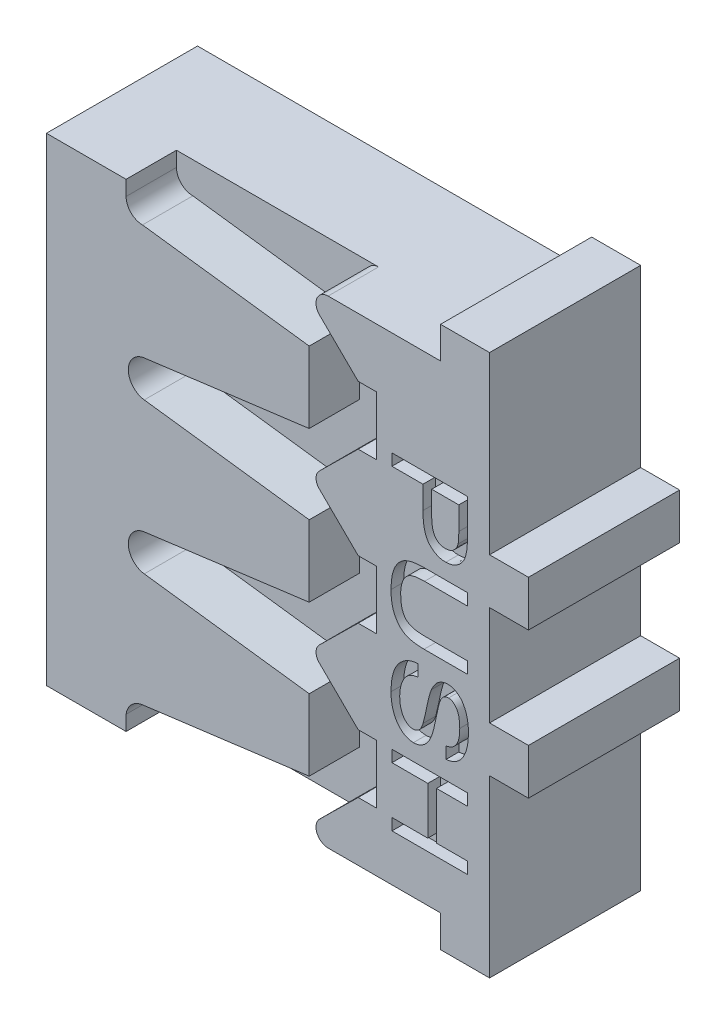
SolidWorks part; units mm, degrees
ref_plane "Plan de face" through (0, 0, 0) normal (0, 0, 1) x (1, 0, 0)
ref_plane "Plan de dessus" through (0, 0, 0) normal (0, 1, 0) x (1, 0, 0)
ref_plane "Plan de droite" through (0, 0, 0) normal (1, 0, 0) x (0, 0, -1)
sketch "Esquisse1" plane through (0, 0, 0) normal (0, 0, 1) x (1, 0, 0)
  line L35 (-2.5501, 0.5149) -> (-2.4893, 0.4539)
  line L36 (-2.701, 0.5149) -> (-2.0714, 0.5149)
  line L37 (-2.0714, 0.5149) -> (-1.3877, 0.4008)
  line L38 (-1.3877, 0.4008) -> (-1.2172, 0.4008)
  line L39 (-2.5501, 0.682) -> (-2.4893, 0.7426)
  line L40 (-2.701, 0.682) -> (-2.0714, 0.682)
  line L41 (-2.0714, 0.682) -> (-1.3877, 0.7956)
  line L42 (-1.3877, 0.7956) -> (-1.2172, 0.7956)
  line L43 (-0.8999, 1.3159) -> (-1.2011, 1.3159)
  line L44 (-1.2011, 1.3159) -> (-1.2011, 1.0799)
  line L45 (-1.2011, 1.0799) -> (-0.8999, 1.0799)
  line L46 (-2.6172, 1.8995) -> (-2.6172, 2.2877)
  line L47 (-2.6172, 2.2877) -> (-1.0573, 2.2877)
  line L48 (-1.0573, 2.2877) -> (-1.0573, 1.8981)
  line L49 (-2.5442, 1.7055) -> (-2.4893, 1.6504)
  line L50 (-2.5966, 1.7055) -> (-2.0714, 1.7055)
  line L51 (-2.0714, 1.7055) -> (-1.4547, 1.6025)
  line L52 (-1.4547, 1.6025) -> (-1.2149, 1.6025)
  line L53 (0.309, 0.7598) -> (0, 0.7598)
  line L54 (-2.6172, 2.1506) -> (-1.0573, 2.1506)
  line L55 (-2.5501, -0.5149) -> (-2.4893, -0.4539)
  line L56 (-2.701, -0.5149) -> (-2.0714, -0.5149)
  line L57 (-2.0714, -0.5149) -> (-1.3877, -0.4008)
  line L58 (-1.3877, -0.4008) -> (-1.2172, -0.4008)
  line L59 (-2.5501, -0.682) -> (-2.4893, -0.7426)
  line L60 (-2.701, -0.682) -> (-2.0714, -0.682)
  line L61 (-2.0714, -0.682) -> (-1.3877, -0.7956)
  line L62 (-1.3877, -0.7956) -> (-1.2172, -0.7956)
  line L63 (-0.8999, -1.3159) -> (-1.2011, -1.3159)
  line L64 (-1.2011, -1.3159) -> (-1.2011, -1.0795)
  line L65 (-1.2011, -1.0795) -> (-0.8999, -1.0795)
  line L66 (-2.6172, -1.8995) -> (-2.6172, -2.2877)
  line L67 (-2.6172, -2.2877) -> (-1.0573, -2.2877)
  line L68 (-1.0573, -2.2877) -> (-1.0573, -1.8981)
  line L69 (0, -0.7598) -> (0, -2.1509)
  line L70 (0, -2.1509) -> (-0.3891, -2.1509)
  line L71 (-0.3891, -2.1509) -> (-0.3891, -1.8981)
  line L72 (-0.3891, -1.8981) -> (-1.2819, -1.8981)
  line L73 (-1.3519, -1.7351) -> (-1.0435, -1.4313)
  line L74 (-1.0435, -1.4313) -> (-0.8999, -1.4313)
  line L75 (-0.8999, -1.4313) -> (-0.8999, -0.9645)
  line L76 (-0.8999, -0.9645) -> (-1.0435, -0.9645)
  line L77 (-1.0435, -0.9645) -> (-1.3519, -0.6606)
  line L78 (-1.3519, -0.5362) -> (-1.0435, -0.2324)
  line L79 (-1.0435, -0.2324) -> (-0.8999, -0.2324)
  line L80 (-0.8999, -0.2324) -> (-0.8999, 0.2324)
  line L81 (-0.8999, 0.2324) -> (-1.0435, 0.2324)
  line L82 (-1.0435, 0.2324) -> (-1.3519, 0.5362)
  line L83 (-1.3519, 0.6603) -> (-1.0435, 0.9645)
  line L84 (-1.0435, 0.9645) -> (-0.8999, 0.9645)
  line L85 (-0.8999, 0.9645) -> (-0.8999, 1.4313)
  line L86 (-0.8999, 1.4313) -> (-1.0435, 1.4313)
  line L87 (-1.0435, 1.4313) -> (-1.3519, 1.7351)
  line L88 (-1.2819, 1.8981) -> (-0.3891, 1.8981)
  line L89 (-0.3891, 1.8981) -> (-0.3891, 2.1506)
  line L90 (-0.3891, 2.1506) -> (0, 2.1506)
  line L91 (0, 2.1506) -> (0, 0.7598)
  line L92 (-2.5442, -1.7055) -> (-2.4893, -1.6504)
  line L93 (-2.5966, -1.7055) -> (-2.0714, -1.7055)
  line L94 (-2.0714, -1.7055) -> (-1.4547, -1.6025)
  line L95 (-1.4547, -1.6025) -> (-1.2149, -1.6025)
  line L96 (0, -0.8556) -> (0.309, -0.8556)
  line L97 (0.309, -0.8556) -> (0.309, -0.3967)
  line L98 (0.309, -0.3967) -> (0, -0.3967)
  line L99 (0, -0.3967) -> (0, 0.3967)
  line L100 (0, 0.3967) -> (0.309, 0.3967)
  line L101 (0.309, 0.3967) -> (0.309, 0.8559)
  line L102 (0.309, 0.8559) -> (0, 0.8559)
  line L103 (0.309, -0.7598) -> (0, -0.7598)
  line L104 (-2.6172, -2.1509) -> (-1.0573, -2.1509)
  line L105 (-2.5966, -1.6504) -> (-2.5966, -1.8995)
  line L106 (-2.5966, -1.8995) -> (-3.5193, -1.8995)
  line L107 (-3.5193, -1.8995) -> (-3.5193, 1.8995)
  line L108 (-3.5193, 1.8995) -> (-2.5966, 1.8995)
  line L109 (-2.5966, 1.8995) -> (-2.5966, 1.6504)
  line L110 (-2.7423, 0.7426) -> (-1.4325, 0.9121)
  line L111 (-1.4325, 0.9121) -> (-1.4325, 1.4792)
  line L112 (-1.4325, 1.4792) -> (-2.7564, 1.6504)
  line L113 (-2.701, 0.7426) -> (-2.701, 0.4539)
  line L114 (-0.8999, 0.117) -> (-1.2011, 0.117)
  line L115 (-1.2011, 0.117) -> (-1.2011, -0.1194)
  line L116 (-1.2011, -0.1194) -> (-0.8999, -0.1194)
  line L117 (-2.7423, -0.4539) -> (-1.4325, -0.2827)
  line L118 (-1.4325, -0.2827) -> (-1.4325, 0.2844)
  line L119 (-1.4325, 0.2844) -> (-2.7423, 0.4539)
  line L120 (-2.8866, -1.8995) -> (-2.8866, -1.7806)
  line L121 (-2.7564, -1.6504) -> (-2.133, -1.6504)
  line L122 (-2.133, -1.6504) -> (-1.3932, -1.5546)
  line L123 (-1.3932, -1.5546) -> (-1.3932, -0.8387)
  line L124 (-1.3932, -0.8387) -> (-2.133, -0.7426)
  line L125 (-2.133, -0.7426) -> (-2.7423, -0.7426)
  line L126 (-2.7423, -0.4539) -> (-2.133, -0.4539)
  line L127 (-2.133, -0.4539) -> (-1.3932, -0.3581)
  line L128 (-1.3932, -0.3581) -> (-1.3932, 0.3581)
  line L129 (-1.3932, 0.3581) -> (-2.133, 0.4539)
  line L130 (-2.133, 0.4539) -> (-2.7423, 0.4539)
  line L131 (-2.7423, 0.7426) -> (-2.133, 0.7426)
  line L132 (-2.133, 0.7426) -> (-1.3932, 0.8387)
  line L133 (-1.3932, 0.8387) -> (-1.3932, 1.5546)
  line L134 (-1.3932, 1.5546) -> (-2.133, 1.6504)
  line L135 (-2.133, 1.6504) -> (-2.7564, 1.6504)
  line L136 (-2.8866, 1.7809) -> (-2.8866, 1.8995)
  line L137 (-2.7423, -0.7426) -> (-1.4325, -0.9121)
  line L138 (-1.4325, -0.9121) -> (-1.4325, -1.4792)
  line L139 (-1.4325, -1.4792) -> (-2.7564, -1.6504)
  line L140 (-2.701, -0.7426) -> (-2.701, -0.4539)
  line L141 (-0.7752, 1.1501) -> (-0.7752, -0.9096) construction
  line L142 (-3.3174, -1.001) -> (-3.3174, -1.3134) construction
  spline S19 degree 3 poles (-1.2819, -1.8981) (-1.3377, -1.8981) (-1.3827, -1.8533) (-1.3827, -1.7971) knots 4 4 4 4 5 5 5 5
  spline S20 degree 3 poles (-1.3827, -1.7971) (-1.3827, -1.7744) (-1.3679, -1.7537) (-1.3519, -1.7351) knots 5 5 5 5 6 6 6 6
  spline S21 degree 3 poles (-1.3519, -0.6606) (-1.3679, -0.642) (-1.3827, -0.6213) (-1.3827, -0.5982) knots 11 11 11 11 12 12 12 12
  spline S22 degree 3 poles (-1.3827, -0.5982) (-1.3827, -0.5752) (-1.3679, -0.5545) (-1.3519, -0.5362) knots 12 12 12 12 13 13 13 13
  spline S23 degree 3 poles (-1.3519, 0.5362) (-1.3679, 0.5545) (-1.3827, 0.5755) (-1.3827, 0.5982) knots 18 18 18 18 19 19 19 19
  spline S24 degree 3 poles (-1.3827, 0.5982) (-1.3827, 0.6213) (-1.3679, 0.6423) (-1.3519, 0.6603) knots 19 19 19 19 20 20 20 20
  spline S25 degree 3 poles (-1.3519, 1.7351) (-1.3679, 1.7534) (-1.3827, 1.7744) (-1.3827, 1.7975) knots 25 25 25 25 26 26 26 26
  spline S26 degree 3 poles (-1.3827, 1.7975) (-1.3827, 1.8529) (-1.3377, 1.8981) (-1.2819, 1.8981) knots 26 26 26 26 27 27 27 27
  spline S27 degree 3 poles (-2.8866, -1.7806) (-2.8866, -1.7089) (-2.8284, -1.6504) (-2.7564, -1.6504) knots 1 1 1 1 2 2 2 2
  spline S28 degree 3 poles (-2.7423, -0.7426) (-2.8222, -0.7426) (-2.8866, -0.6782) (-2.8866, -0.5982) knots 7 7 7 7 8 8 8 8
  spline S29 degree 3 poles (-2.8866, -0.5982) (-2.8866, -0.5187) (-2.8222, -0.4539) (-2.7423, -0.4539) knots 8 8 8 8 9 9 9 9
  spline S30 degree 3 poles (-2.7423, 0.4539) (-2.8222, 0.4539) (-2.8866, 0.5187) (-2.8866, 0.5982) knots 14 14 14 14 15 15 15 15
  spline S31 degree 3 poles (-2.8866, 0.5982) (-2.8866, 0.6778) (-2.8222, 0.7426) (-2.7423, 0.7426) knots 15 15 15 15 16 16 16 16
  spline S32 degree 3 poles (-2.7564, 1.6504) (-2.8284, 1.6504) (-2.8866, 1.7086) (-2.8866, 1.7809) knots 21 21 21 21 22 22 22 22
  text T1 "PUSH" font "ARIAL" height 0.6559
  text T2 "3" font "ARIAL" height 0.4778
sketch "Esquisse2" plane through (0, 0, 0) normal (0, 0, 1) x (1, 0, 0)
  line L0 (-3.5193, -1.8995) -> (-0.3891, -1.8981)
  line L1 (-0.3891, -1.8981) -> (-0.3891, -2.1509)
  line L2 (-0.3891, -2.1509) -> (0, -2.1509)
  line L3 (0, -2.1509) -> (0, -0.7598)
  line L4 (0, -0.7598) -> (0.309, -0.7598)
  line L5 (0.309, -0.7598) -> (0.309, -0.3967)
  line L6 (0.309, -0.3967) -> (0, -0.3967)
  line L7 (0, -0.3967) -> (0, 0.3967)
  line L8 (0, 0.3967) -> (0.309, 0.3967)
  line L9 (0.309, 0.3967) -> (0.309, 0.7598)
  line L10 (0.309, 0.7598) -> (0, 0.7598)
  line L11 (0, 0.7598) -> (0, 2.1506)
  line L12 (0, 2.1506) -> (-0.3891, 2.1506)
  line L13 (-0.3891, 2.1506) -> (-0.3891, 1.8981)
  line L14 (-0.3891, 1.8981) -> (-3.5193, 1.8995)
  line L15 (-3.5193, 1.8995) -> (-3.5193, -1.8995)
extrude "Extrusion1" add sketch "Esquisse2" against normal blind 1.2
sketch "Esquisse3" plane through (0, 0, -1.2) normal (0, 0, -1) x (-1, 0, 0)
  line L0 (2.8866, 1.8995) -> (2.8866, 1.7809)
  line L1 (2.7564, 1.6504) -> (1.4325, 1.4792)
  line L2 (1.4325, 1.4792) -> (1.4325, 0.9121)
  line L3 (1.4325, 0.9121) -> (2.7423, 0.7426)
  line L4 (2.7423, 0.4539) -> (1.4325, 0.2844)
  line L5 (1.4325, 0.2844) -> (1.4325, -0.2827)
  line L6 (1.4325, -0.2827) -> (2.7423, -0.4539)
  line L7 (2.7423, -0.7426) -> (1.4325, -0.9121)
  line L8 (1.4325, -0.9121) -> (1.4325, -1.4792)
  line L9 (1.4325, -1.4792) -> (2.7564, -1.6504)
  line L10 (2.8866, -1.7806) -> (2.8866, -1.8995)
  line L11 (2.8866, -1.8995) -> (2.8866, -1.9488)
  line L12 (1.3519, -1.7351) -> (1.0435, -1.4313)
  line L14 (1.0435, -1.4313) -> (0.8999, -1.4313)
  line L15 (0.8999, -1.4313) -> (0.8999, -0.9645)
  line L16 (0.8999, -0.9645) -> (1.0435, -0.9645)
  line L17 (1.0435, -0.9645) -> (1.3519, -0.6606)
  line L18 (1.3519, -0.5362) -> (1.0435, -0.2324)
  line L19 (1.0435, -0.2324) -> (0.8999, -0.2324)
  line L20 (0.8999, -0.2324) -> (0.8999, 0.2324)
  line L21 (0.8999, 0.2324) -> (1.0435, 0.2324)
  line L22 (1.0435, 0.2324) -> (1.3519, 0.5362)
  line L23 (1.3519, 0.6603) -> (1.0435, 0.9645)
  line L24 (1.0435, 0.9645) -> (0.8999, 0.9645)
  line L25 (0.8999, 0.9645) -> (0.8999, 1.4313)
  line L26 (0.8999, 1.4313) -> (1.0435, 1.4313)
  line L27 (1.0435, 1.4313) -> (1.3519, 1.7351)
  line L28 (1.2819, 1.8981) -> (1.2819, 1.9255)
  line L29 (1.2819, 1.9255) -> (2.8866, 1.9255)
  line L30 (2.8866, 1.9255) -> (2.8866, 1.8995)
  line L31 (2.8866, -1.9488) -> (1.2819, -1.9488)
  line L32 (1.2819, -1.9488) -> (1.2819, -1.8981)
  arc A0 (2.8866, 1.7809) -> (2.7564, 1.6504) centre (2.7561, 1.7809) cw
  arc A1 (2.7423, 0.7426) -> (2.7423, 0.4539) centre (2.7236, 0.5982) cw
  arc A2 (2.7423, -0.4539) -> (2.7423, -0.7426) centre (2.7234, -0.5982) cw
  arc A3 (2.7564, -1.6504) -> (2.8866, -1.7806) centre (2.7371, -1.7999) cw
  arc A4 (1.2819, -1.8981) -> (1.3519, -1.7351) centre (1.282, -1.8016) ccw
  arc A5 (1.3519, -0.6606) -> (1.3519, -0.5362) centre (1.2906, -0.5984) ccw
  arc A6 (1.3519, 0.5362) -> (1.3519, 0.6603) centre (1.2907, 0.5982) ccw
  arc A7 (1.3519, 1.7351) -> (1.2819, 1.8981) centre (1.282, 1.8016) ccw
extrude "Enlèv. mat.-Extru.1" cut sketch "Esquisse3" along normal blind 0.4 from vertex at -1.2
sketch "Esquisse4" plane through (-3.5193, 0, 0) normal (-1, 0, 0) x (0, 0, 1)
  line L0 (0, 0) -> (-1.2, 0) construction
  line L1 (-0.2, 1.7) -> (-1, 1.7)
  line L2 (-0.2, 1.7) -> (-0.2, 0.7)
  line L3 (-0.2, 0.7) -> (-1, 0.7)
  line L4 (-1, 1.7) -> (-1, 0.7)
  line L5 (-0.2, 0.5) -> (-1, 0.5)
  line L6 (-0.2, 0.5) -> (-0.2, -0.5)
  line L7 (-0.2, -0.5) -> (-1, -0.5)
  line L8 (-1, 0.5) -> (-1, -0.5)
  line L9 (-0.2, -0.7) -> (-1, -0.7)
  line L10 (-0.2, -0.7) -> (-0.2, -1.7)
  line L11 (-0.2, -1.7) -> (-1, -1.7)
  line L12 (-1, -0.7) -> (-1, -1.7)
  line L13 (0, 1.8995) -> (0, -1.8995) construction
  line L14 (-1.2, 1.8995) -> (-1.2, -1.8995) construction
  line L15 (0, -1.8995) -> (0, 1.8995) construction
  point P18 (-0.2, 0)
  dimension "D1" = 1.2
  dimension "D2" = 1.2
  dimension "D3" = 0.2
  dimension "L" = 1
  dimension "D4" = 0.2
extrude "Enlèv. mat.-Extru.2" cut sketch "Esquisse4" against normal blind 2 draft 10
sketch "Esquisse6" plane through (0, 0, 0) normal (0, 0, 1) x (1, 0, 0)
  line L0 (-0.7752, 1.1501) -> (-0.7752, -1.1501) construction
  text T0 "PUSH" font "Arial" height 0.6
  point P4 (-0.7752, 0)
extrude "Enlèv. mat.-Extru.3" cut sketch "Esquisse6" against normal blind 0.1
